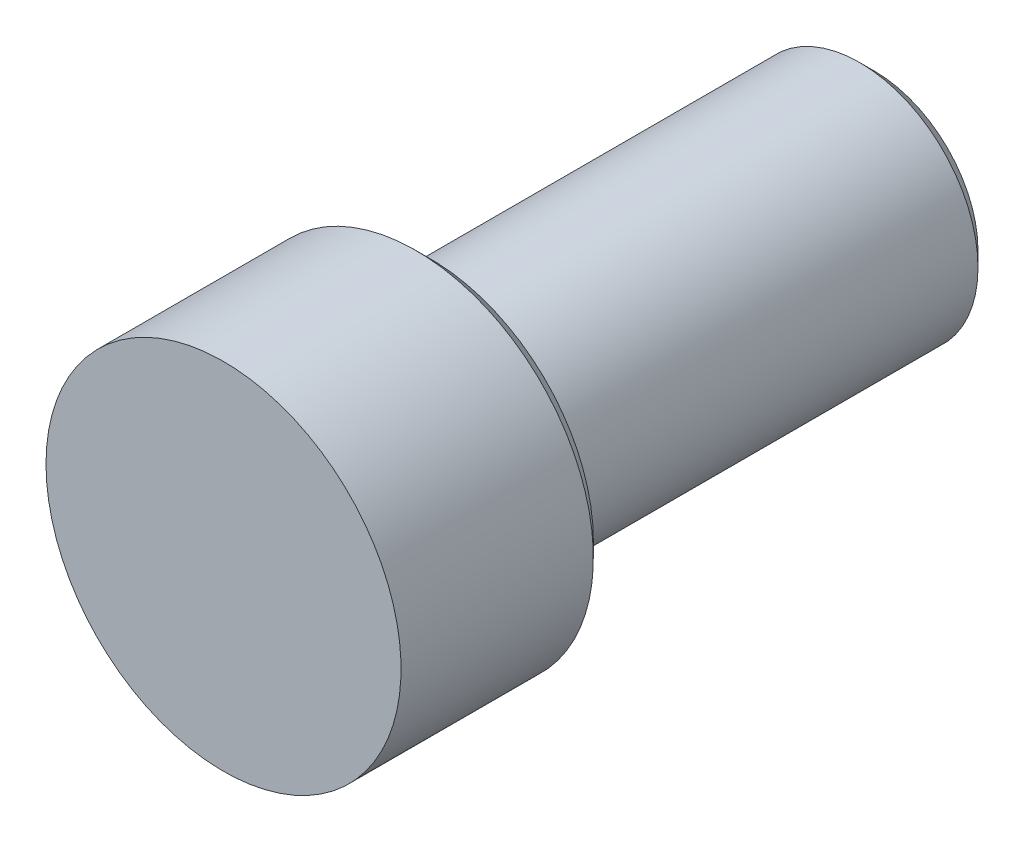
SolidWorks part; units mm, degrees
ref_plane "Front Plane" through (0, 0, 0) normal (0, 0, 1) x (1, 0, 0)
ref_plane "Top Plane" through (0, 0, 0) normal (0, 1, 0) x (1, 0, 0)
ref_plane "Right Plane" through (0, 0, 0) normal (1, 0, 0) x (0, 0, -1)
body saved out of another part "Stock-Piranha-h0400-4301-1"
